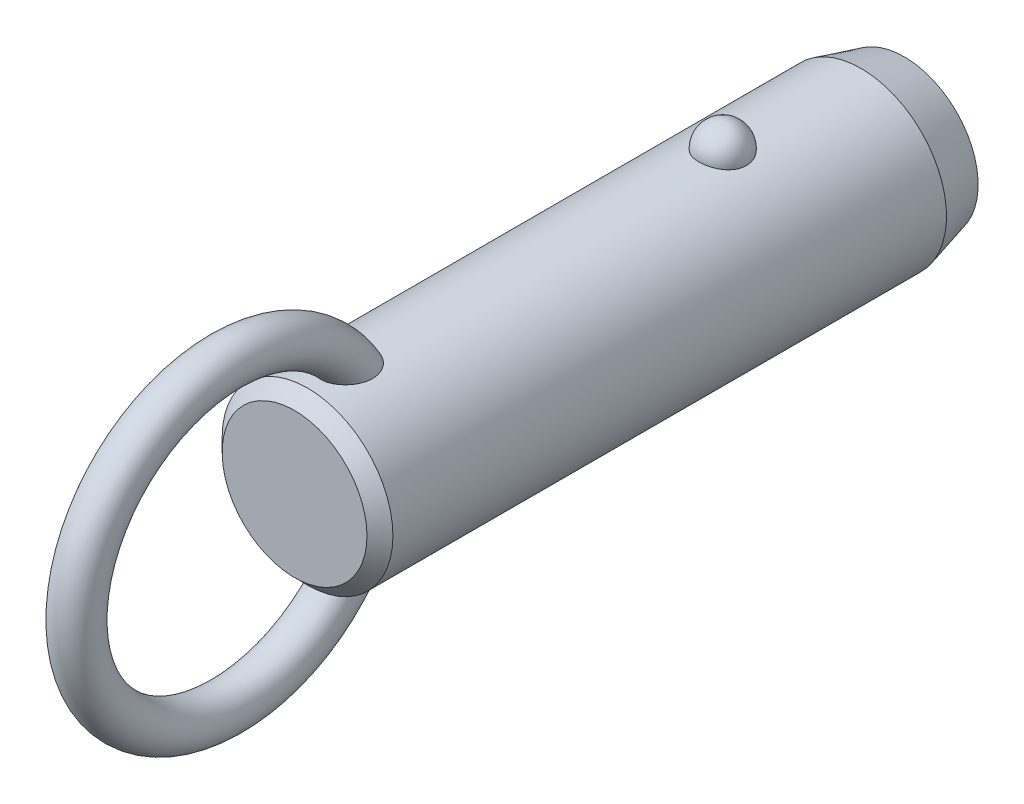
SolidWorks part; units mm, degrees
ref_plane "Front Plane" through (0, 0, 0) normal (0, 0, 1) x (1, 0, 0)
ref_plane "Top Plane" through (0, 0, 0) normal (0, 1, 0) x (1, 0, 0)
ref_plane "Right Plane" through (0, 0, 0) normal (1, 0, 0) x (0, 0, -1)
sketch "Sketch2" plane through (0, 0, 0) normal (0, 0, 1) x (1, 0, 0)
  circle A0 centre (0, 0) radius 7.9
  point P3 (0, 7.9)
  dimension "D1" = 15.8
extrude "Boss-Extrude1" add sketch "Sketch2" along normal blind 27.9
sketch "Sketch3" plane through (0, 0, 0) normal (0, 0, -1) x (-1, 0, 0)
  circle A0 centre (0, 0) radius 7.9
  dimension "D1" = 15.8
extrude "Boss-Extrude2" add sketch "Sketch3" along normal blind 19
chamfer "Chamfer1" distance 4 angle 15 1 edges at (-7.9, 0, -19)
sketch "Sketch12" plane through (0, 0, 0) normal (1, 0, 0) x (0, 0, -1)
  line L0 (-27.9, 7.9) -> (-27.9, -7.9) construction
  point P0 (-27.9, 0)
sketch "Sketch13" plane through (0, 0, 0) normal (1, 0, 0) x (0, 0, -1)
  circle A0 centre (-43.75, 0) radius 15.85
  point P2 (-27.9, 0)
  dimension "D1" = 31.7
sketch "Sketch14" plane through (0, 0, 0) normal (0, 1, 0) x (1, 0, 0)
  circle A0 centre (0, -29.9) radius 2
  point P2 (0, -27.9)
  dimension "D1" = 4
sweep "Sweep1" add profiles "Sketch14" path "Sketch13"
sketch "Sketch15" plane through (0, 0, 27.9) normal (0, 0, 1) x (1, 0, 0)
  circle A0 centre (0, 0) radius 7.9
  dimension "D1" = 15.8
extrude "Boss-Extrude3" add sketch "Sketch15" along normal blind 9.52
chamfer "Chamfer2" distance 1.2 angle 45 1 edges at (7.9, 0, 37.42)
sketch "Sketch18" plane through (0, 0, 0) normal (1, 0, 0) x (0, 0, -1)
  line L0 (15, 7.9) -> (-30.0091, 7.9) construction
  line L1 (2.2, 10.1) -> (2.2, 5.7)
  line L2 (-30.0091, -7.9) -> (15, -7.9) construction
  arc A0 (2.2, 10.1) -> (2.2, 5.7) centre (2.2, 7.9) ccw
  point P4 (0, 7.9)
  dimension "D1" = 18
revolve "Revolve1" add sketch "Sketch18" angle 360 about L1
